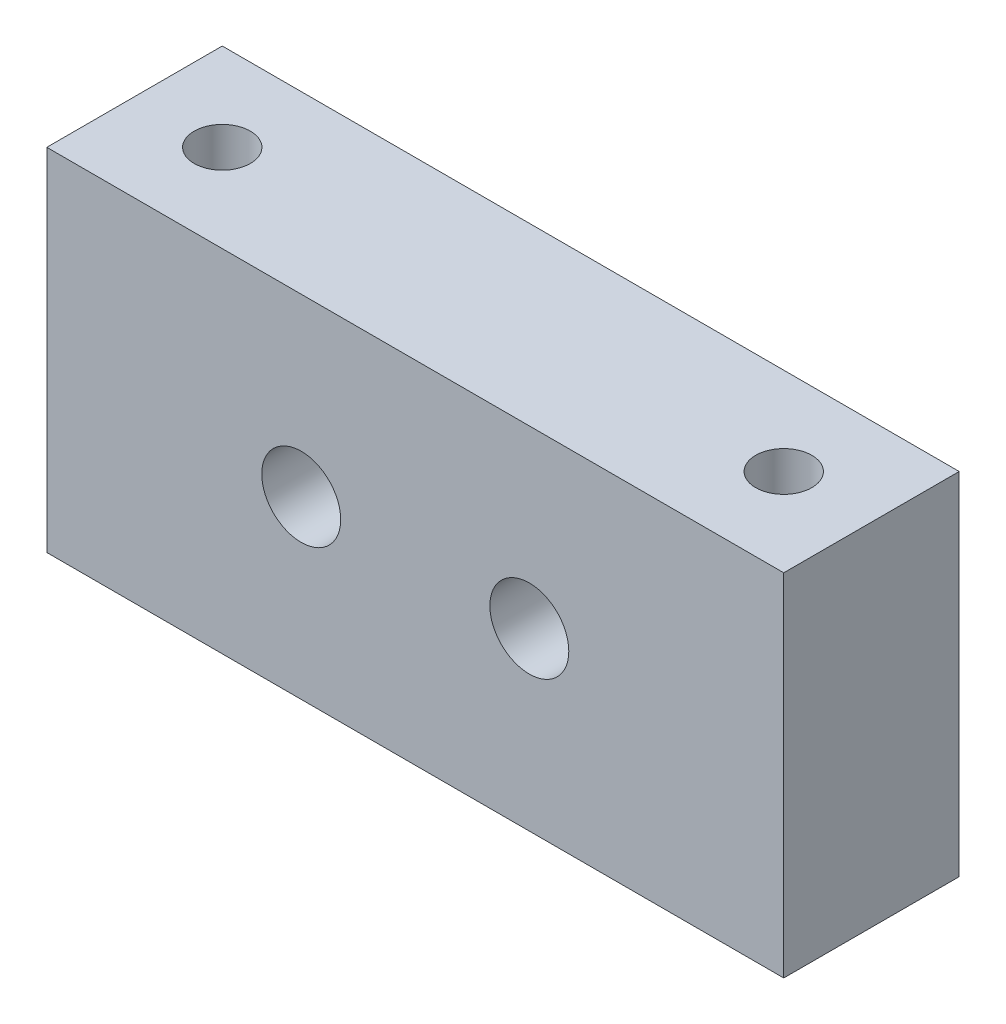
SolidWorks part; units mm, degrees
ref_plane "Alzado" through (0, 0, 0) normal (0, 0, 1) x (1, 0, 0)
ref_plane "Planta" through (0, 0, 0) normal (0, 1, 0) x (1, 0, 0)
ref_plane "Vista lateral" through (0, 0, 0) normal (1, 0, 0) x (0, 0, -1)
sketch "Croquis1" plane through (0, 0, 0) normal (0, 0, 1) x (1, 0, 0)
  line L1 (-21, -10) -> (21, -10)
  line L2 (-21, -10) -> (-21, 10)
  line L3 (-21, 10) -> (21, 10)
  line L4 (21, -10) -> (21, 10)
  line L5 (-21, -10) -> (21, 10) construction
  line L6 (-21, 10) -> (21, -10) construction
  point P0 (0, 0)
  dimension "D1" = 42
  dimension "D2" = 20
extrude "Saliente-Extruir1" add sketch "Croquis1" along normal blind 10 contours L3 L4 L1 L2
sketch "Croquis2" plane through (0, 0, 10) normal (0, 0, 1) x (1, 0, 0)
  line L0 (-21, -10) -> (-21, 10) construction
  line L1 (21, -10) -> (21, 10) construction
  circle A0 centre (-6.5, 0) radius 2.25
  circle A1 centre (6.5, 0) radius 2.25
  dimension "D1" = 14.5
  dimension "D2" = 14.5
extrude "Cortar-Extruir1" cut sketch "Croquis2" against normal blind 10
sketch "Croquis3" plane through (0, 10, 0) normal (0, 1, 0) x (1, 0, 0)
  line L0 (-21, -10) -> (-21, 0) construction
  line L1 (21, -10) -> (21, 0) construction
  circle A0 centre (-16, -5) radius 1.6
  circle A1 centre (16, -5) radius 1.6
  dimension "D1" = 5
  dimension "D2" = 5
extrude "Schnitt-Linear austragen1" cut sketch "Croquis3" against normal blind 20
